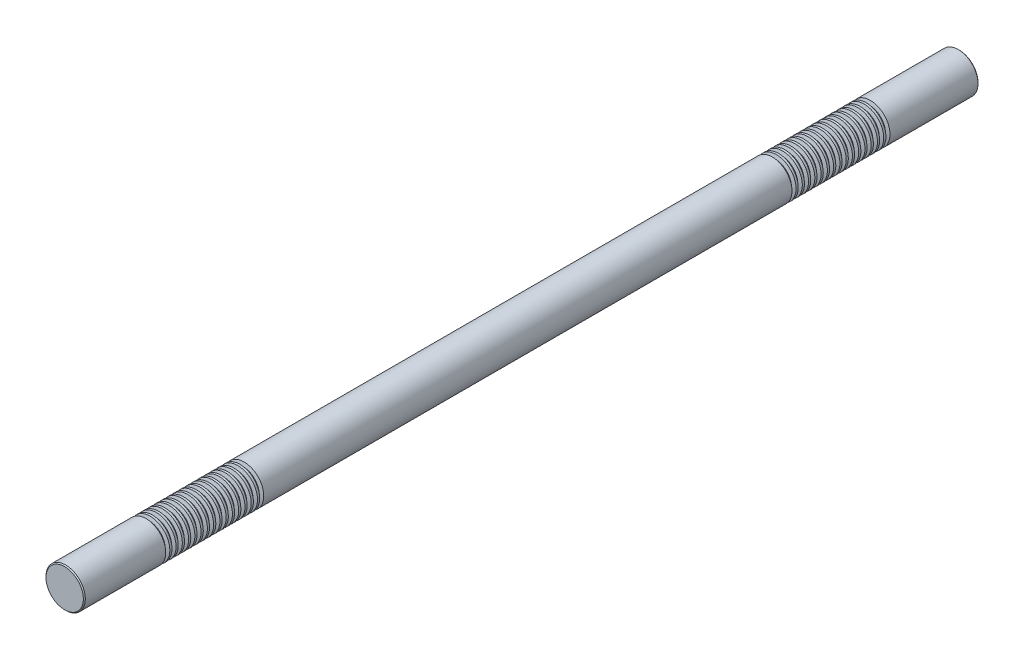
SolidWorks part; units mm, degrees
ref_plane "Front Plane" through (0, 0, 0) normal (0, 0, 1) x (1, 0, 0)
ref_plane "Top Plane" through (0, 0, 0) normal (0, 1, 0) x (1, 0, 0)
ref_plane "Right Plane" through (0, 0, 0) normal (1, 0, 0) x (0, 0, -1)
sketch "Sketch1" plane through (0, 0, 0) normal (0, 0, 1) x (1, 0, 0)
  circle A0 centre (0, 0) radius 22
  dimension "D1" = 44
extrude "Boss-Extrude1" add sketch "Sketch1" along normal mid plane 1000
chamfer "Chamfer1" distance 1.1 angle 45 2 edges at (22, 0, -500) (22, 0, 500)
sketch "Sketch2" plane through (0, 0, 0) normal (1, 0, 0) x (0, 0, -1)
  line L0 (400.5359, 22) -> (395.9641, 22)
  line L1 (498.9, 22) -> (-498.9, 22) construction
  line L2 (395.9641, 22) -> (397.0359, 18)
  line L3 (397.0359, 18) -> (399.4641, 18)
  line L4 (399.4641, 18) -> (400.5359, 22)
  line L5 (500, -20.9) -> (500, 20.9) construction
  point P4 (398.25, 22)
  point P7 (398.25, 18)
  point P8 (400, 20)
  point P9 (396.5, 20)
  dimension "D1" = 3.5
  dimension "D2" = 100
  dimension "D3" = 4
  dimension "D4" = 30
revolve "Cut-Revolve1" cut sketch "Sketch2" angle 360 about axis through (0, 0, 500) along (0, 0, -1)
pattern_linear "LPattern1" count 16 spacing 7 along (0, 0, 1) of "Cut-Revolve1"
pattern_linear "LPattern2" count 2 spacing 700 along (0, 0, 1) of "Cut-Revolve1", "LPattern1"
